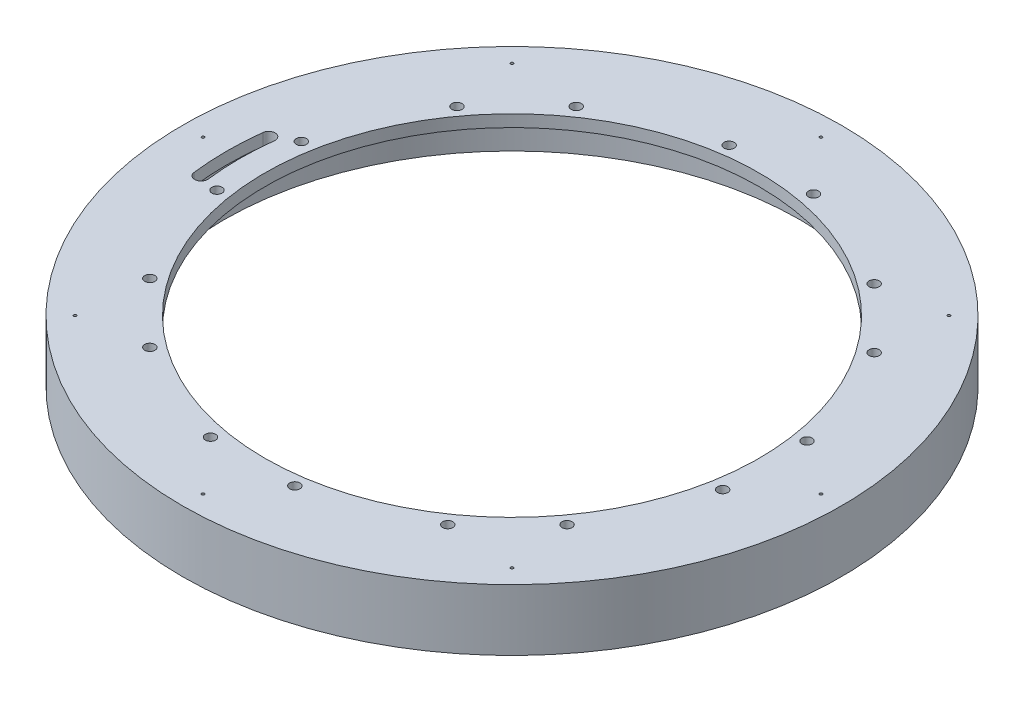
SolidWorks part; units mm, degrees
ref_plane "Front Plane" through (0, 0, 0) normal (0, 0, 1) x (1, 0, 0)
ref_plane "Top Plane" through (0, 0, 0) normal (0, 1, 0) x (1, 0, 0)
ref_plane "Right Plane" through (0, 0, 0) normal (1, 0, 0) x (0, 0, -1)
sketch "Sketch1" plane through (0, 0, 0) normal (0, 1, 0) x (1, 0, 0)
  circle A0 centre (0, 0) radius 101.6
extrude "Boss-Extrude1" add sketch "Sketch1" along normal blind 18.923
sketch "Sketch2" plane through (0, 0, 0) normal (0, -1, 0) x (-1, 0, 0)
  circle A0 centre (0, 0) radius 88.9
extrude "Cut-Extrude1" cut sketch "Sketch2" against normal blind 15.24
sketch "Sketch3" plane through (0, 18.923, 0) normal (0, 1, 0) x (1, 0, 0)
  circle A0 centre (0, 0) radius 76.2
extrude "Cut-Extrude2" cut sketch "Sketch3" against normal through all
hole_wizard "Tapped Hole for 1/4-20 Helicoil1" positions "Sketch4" profile "Sketch5" tap size "1/4-20" standard "Helicoil® Inch"
sketch "Sketch4" plane through (0, 0, 0) normal (0, -1, 0) x (-1, 0, 0)
  point P0 (0, -95.25)
  dimension "D1" = 95.25
sketch "Sketch5" plane through (0, 0, 95.25) normal (1, 0, 0) x (0, 0, -1)
  line L0 (0, 0) -> (0, 19.1748)
  line L1 (0, 19.1748) -> (3.3782, 17.145)
  line L2 (3.3782, 17.145) -> (3.3782, 0)
  line L5 (3.3782, 0) -> (0, 0)
  line L10 (0, 19.1748) -> (-3.3782, 17.145) construction
  line L11 (0, -6.35) -> (0, 107.95) construction
  dimension "Tap Drill Dia." = 6.7564
  dimension "Tap Drill Depth" = 17.145
  dimension "Drill Angle" = 118
pattern_circular "CirPattern1" count 8 over 360 about axis through (0, 0, 0) along (0, 1, 0) of "Tapped Hole for 1/4-20 Helicoil1"
sketch "Sketch6" plane through (0, 18.923, 0) normal (0, 1, 0) x (1, 0, 0)
  line L0 (0, 0) -> (0, 95.25)
  line L1 (-17.2021, 78.95) -> (23.8663, 78.95)
  line L2 (-12, 83.1341) -> (-12, 71.1386)
  line L3 (14, 67.4777) -> (14, 85.3151)
  dimension "D1" = 78.95
  dimension "D2" = 14
  dimension "D3" = 12
hole_wizard "Tapped Hole for M3x0.5 Helicoil1" positions "Sketch7" profile "Sketch8" tap size "M3x0.5" standard "Helicoil® Metric"
sketch "Sketch7" plane through (0, 18.923, 0) normal (0, 1, 0) x (1, 0, 0)
  line L0 (-17.2021, 78.95) -> (23.8663, 78.95) construction
  line L1 (-12, 83.1341) -> (-12, 71.1386) construction
  line L2 (14, 67.4777) -> (14, 85.3151) construction
  point P0 (-12, 78.95)
  point P6 (14, 78.95)
sketch "Sketch8" plane through (-12, 18.923, -78.95) normal (1, 0, 0) x (0, 0, 1)
  line L0 (0, 0) -> (0, 11.5964)
  line L1 (0, 11.5964) -> (1.575, 10.65)
  line L2 (1.575, 10.65) -> (1.575, 0)
  line L5 (1.575, 0) -> (0, 0)
  line L10 (0, 11.5964) -> (-1.575, 10.65) construction
  line L11 (0, -6.35) -> (0, 107.95) construction
  dimension "Tap Drill Dia." = 3.15
  dimension "Tap Drill Depth" = 10.65
  dimension "Drill Angle" = 118
pattern_circular "CirPattern2" count 8 over 360 about axis through (0, 0, 0) along (0, 1, 0) of "Tapped Hole for M3x0.5 Helicoil1"
sketch "Sketch11" plane through (0, 18.923, 0) normal (0, 1, 0) x (1, 0, 0)
  arc A0 (-85.2822, 10.26) -> (-85.2429, -10.5815) centre (0, 0) ccw construction
  arc A1 (-87.2678, 10.4988) -> (-87.2276, -10.8278) centre (0, 0) ccw
  arc A2 (-83.2965, 10.0211) -> (-83.2581, -10.3351) centre (0, 0) ccw
  arc A3 (-83.2965, 10.0211) -> (-87.2678, 10.4988) centre (-85.2822, 10.26) ccw
  arc A4 (-87.2276, -10.8278) -> (-83.2581, -10.3351) centre (-85.2429, -10.5815) ccw
  point P4 (-85.897, -0.162)
extrude "Cut-Extrude4" cut sketch "Sketch11" against normal through all
